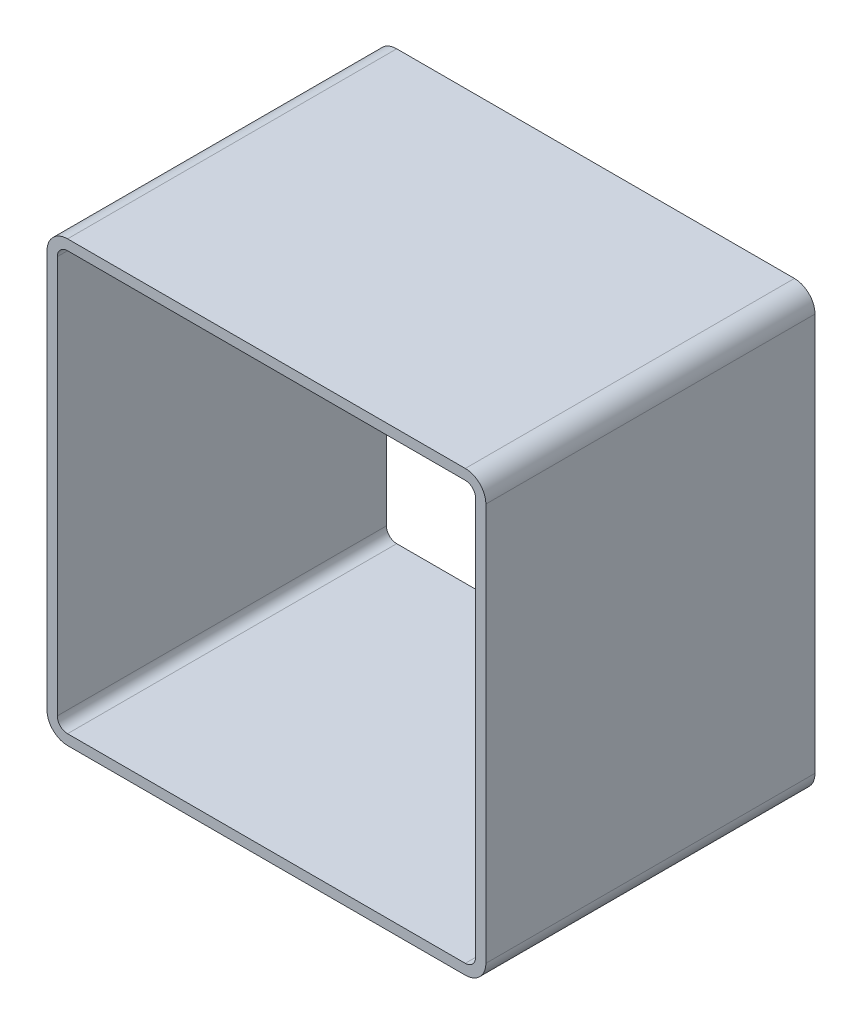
SolidWorks part; units mm, degrees
ref_plane "Front Plane" through (0, 0, 0) normal (0, 0, 1) x (1, 0, 0)
ref_plane "Top Plane" through (0, 0, 0) normal (0, 1, 0) x (1, 0, 0)
ref_plane "Right Plane" through (0, 0, 0) normal (1, 0, 0) x (0, 0, -1)
sketch "Sketch1" plane through (0, 0, 0) normal (0, 0, 1) x (1, 0, 0)
sketch_block_instance "HSS16x16x0.375-1"
sketch_block "HSS16x16x0.375"
extrude "Boss-Extrude1" add sketch "Sketch1" along normal blind 304.8
